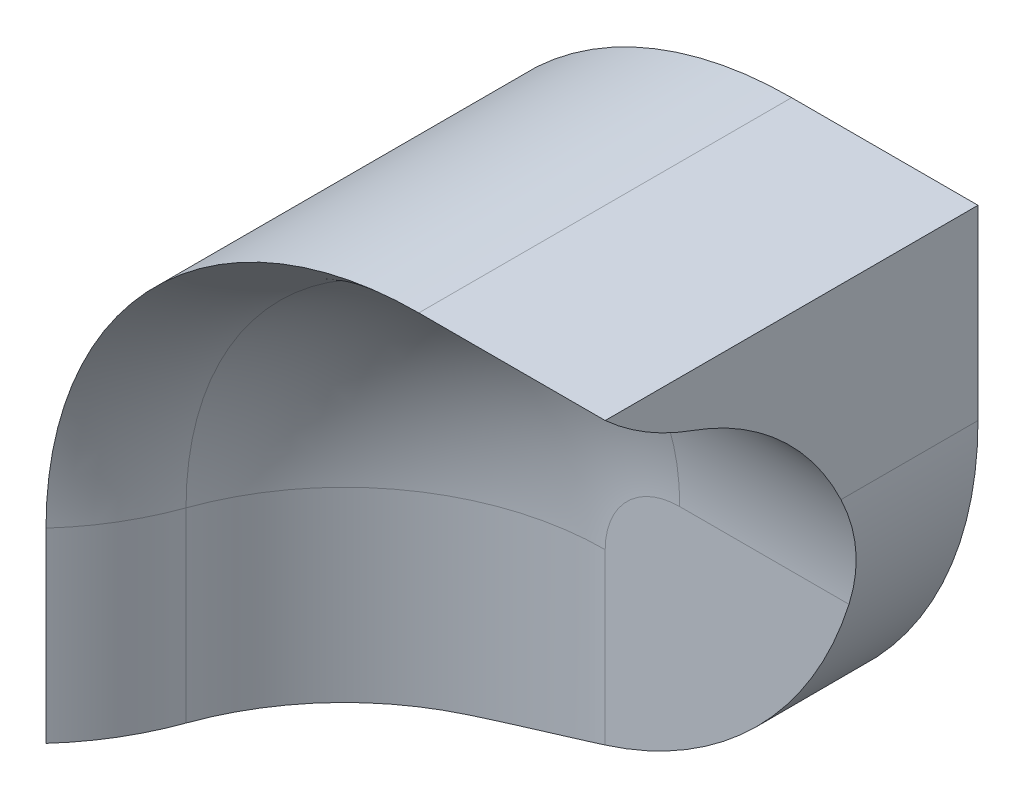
SolidWorks part; units mm, degrees
ref_plane "Ebene vorne" through (0, 0, 0) normal (0, 0, 1) x (1, 0, 0)
ref_plane "Ebene oben" through (0, 0, 0) normal (0, 1, 0) x (1, 0, 0)
ref_plane "Ebene rechts" through (0, 0, 0) normal (1, 0, 0) x (0, 0, -1)
sketch "Skizze1" plane through (0, 0, 0) normal (0, 0, 1) x (1, 0, 0)
  line L1 (-7.5, -7.5) -> (-2.5, -7.5)
  line L2 (-7.5, -7.5) -> (-7.5, -2.5)
  line L3 (2.5, 7.5) -> (7.5, 7.5)
  line L4 (7.5, 2.5) -> (7.5, 7.5)
  line L5 (-7.5, -7.5) -> (7.5, 7.5) construction
  line L6 (-7.5, 7.5) -> (7.5, -7.5) construction
  arc A1 (-2.5, -7.5) -> (7.5, 2.5) centre (-2.5, 2.5) ccw
  arc A2 (-7.5, -2.5) -> (2.5, 7.5) centre (2.5, -2.5) cw
  point P0 (0, 0)
  dimension "D1" = 10
  dimension "D2" = 15
extrude "Aufsatz-Linear austragen1" add sketch "Skizze1" along normal blind 3
sketch "Skizze4" plane through (0, 0, 3) normal (0, 0, 1) x (1, 0, 0)
  line L0 (-7.5, -2.5) -> (-7.5, -7.5) construction
  line L1 (7.5, 7.5) -> (2.5, 7.5) construction
  line L2 (-7.5, -2.5) -> (-7.5, -7.5)
  line L3 (7.5, 7.5) -> (2.5, 7.5)
  line L4 (7.5, 6.5) -> (2.5, 6.5)
  line L5 (-6.5, -2.5) -> (-6.5, -7.5)
  line L6 (-6.5, -7.5) -> (-7.5, -7.5)
  line L7 (7.5, 6.5) -> (7.5, 7.5)
  arc A0 (2.5, 7.5) -> (-7.5, -2.5) centre (2.5, -2.5) ccw construction
  arc A1 (2.5, 7.5) -> (-7.5, -2.5) centre (2.5, -2.5) ccw
  arc A2 (2.5, 6.5) -> (-6.5, -2.5) centre (2.5, -2.5) ccw
  dimension "D1" = 1
extrude "Aufsatz-Linear austragen2" add sketch "Skizze4" along normal blind 7
fillet "Verrundung1" radius 7 9 edges at (-4.5, -7.5, 3) (-6.5, -5, 3) (-6.5, -7.5, 6.5) (-3.864, 3.864, 3) (-6.5, -2.5, 6.5) (5, 6.5, 3) (2.5, 6.5, 6.5) (7.5, 6.5, 6.5) (7.5, 4.5, 3)
fillet "Verrundung2" radius 7 5 edges at (-7, -7.5, 10) (-6.5, -5, 10) (-3.864, 3.864, 10) (5, 6.5, 10) (7.5, 7, 10)
sketch "Skizze5" plane through (0, 0, 0) normal (0, 0, -1) x (-1, 0, 0)
  line L0 (0, 0) -> (4.5711, 4.5711) construction
  line L1 (0, 0) -> (-4.5711, -4.5711) construction
  line L2 (2.4497, 2.4497) -> (2.4497, 6.1891) construction
  line L3 (2.4497, 2.4497) -> (6.1891, 2.4497) construction
  line L4 (2.4497, 2.4497) -> (-2.5503, -2.5503) construction
  circle A0 centre (2.4497, 2.4497) radius 2.05
  arc A1 (7.5, -2.5) -> (-2.5, 7.5) centre (-2.5, -2.5) ccw construction
  arc A2 (-7.5, 2.5) -> (2.5, -7.5) centre (2.5, 2.5) ccw construction
  circle A3 centre (-2.5503, -2.5503) radius 2.05
  dimension "D2" = 4.1
  dimension "D1" = 3
  dimension "D3" = 5
extrude "Schnitt-Linear austragen1" cut sketch "Skizze5" against normal blind 1.7
